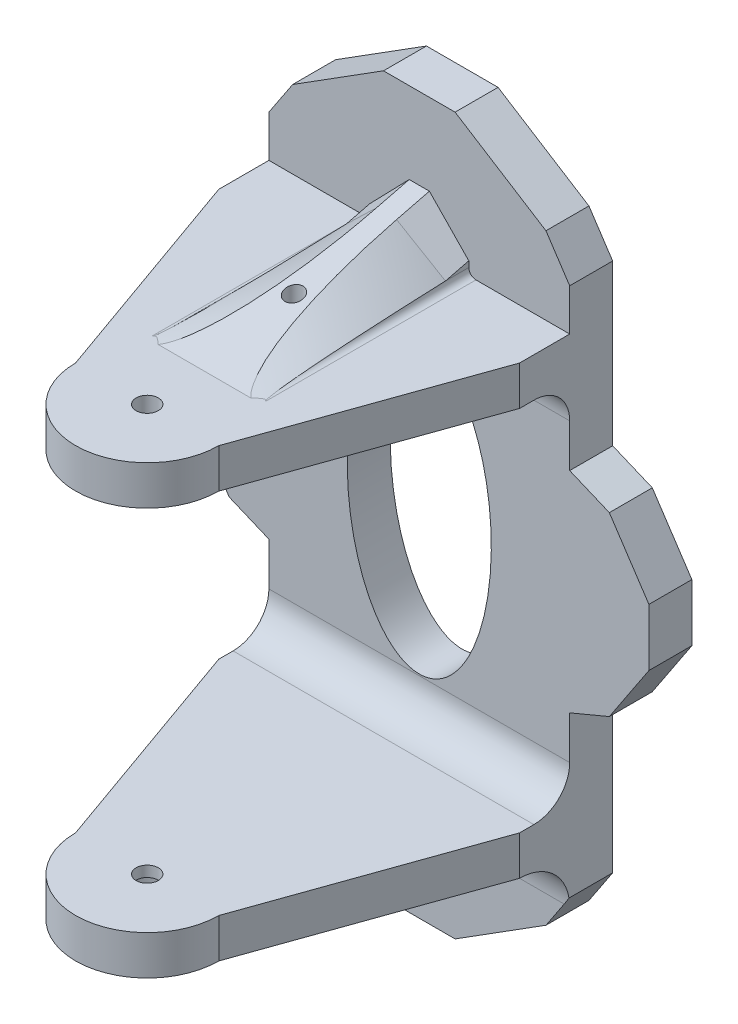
SolidWorks part; units mm, degrees
ref_plane "Front" through (0, 0, 0) normal (0, 0, 1) x (1, 0, 0)
ref_plane "Top" through (0, 0, 0) normal (0, 1, 0) x (1, 0, 0)
ref_plane "Right" through (0, 0, 0) normal (1, 0, 0) x (0, 0, -1)
sketch "Sketch1" plane through (0, 0, 0) normal (0, 0, 1) x (1, 0, 0)
  line L0 (0, 0) -> (0, 100) construction
  line L1 (5, 100) -> (-5, 100)
  line L2 (-5, 100) -> (-17.6886, 92)
  line L3 (-17.6886, 92) -> (-21.0052, 87)
  line L4 (0, 50) -> (-48.9868, 50) construction
  line L5 (-21.0052, 87) -> (-21.0052, 64.6502)
  line L6 (-21.0052, 64.6502) -> (-26.5398, 62.3333)
  line L7 (-26.5398, 62.3333) -> (-32.0676, 54)
  line L8 (-32.0676, 54) -> (-32.0676, 46)
  line L9 (-26.5398, 37.6667) -> (-32.0676, 46)
  line L10 (-21.0052, 35.3498) -> (-26.5398, 37.6667)
  line L11 (-21.0052, 13) -> (-21.0052, 35.3498)
  line L12 (-17.6886, 8) -> (-21.0052, 13)
  line L13 (-5, 0) -> (-17.6886, 8)
  line L14 (5, 0) -> (-5, 0)
  line L15 (5, 0) -> (17.6886, 8)
  line L16 (17.6886, 8) -> (21.0052, 13)
  line L17 (21.0052, 13) -> (21.0052, 35.3498)
  line L18 (21.0052, 35.3498) -> (26.5398, 37.6667)
  line L19 (26.5398, 37.6667) -> (32.0676, 46)
  line L20 (32.0676, 54) -> (32.0676, 46)
  line L21 (26.5398, 62.3333) -> (32.0676, 54)
  line L22 (21.0052, 64.6502) -> (26.5398, 62.3333)
  line L23 (21.0052, 87) -> (21.0052, 64.6502)
  line L24 (17.6886, 92) -> (21.0052, 87)
  line L25 (5, 100) -> (17.6886, 92)
  point P13 (-32.0676, 50)
extrude "Boss-Extrude1" add sketch "Sketch1" along normal blind 6
sketch "Sketch2" plane through (0, 0, 6) normal (0, 0, 1) x (1, 0, 0)
  line L0 (-32.0676, 50) -> (32.0676, 50) construction
  line L1 (-32.0676, 54) -> (-32.0676, 46) construction
  line L2 (32.0676, 46) -> (32.0676, 54) construction
  line L3 (-21.0052, 87) -> (-21.0052, 64.6502) construction
  line L4 (-21.0052, 81.165) -> (21.0052, 81.165)
  line L5 (-21.0052, 81.165) -> (-21.0052, 74.165)
  line L6 (-21.0052, 74.165) -> (21.0052, 74.165)
  line L7 (21.0052, 81.165) -> (21.0052, 74.165)
  line L8 (21.0052, 64.6502) -> (21.0052, 87) construction
  line L9 (21.0052, 18.835) -> (21.0052, 25.835)
  line L10 (-21.0052, 25.835) -> (21.0052, 25.835)
  line L11 (-21.0052, 18.835) -> (-21.0052, 25.835)
  line L12 (-21.0052, 18.835) -> (21.0052, 18.835)
  dimension "D1" = 7
  dimension "D2" = 24.165
extrude "Boss-Extrude2" add sketch "Sketch2" along normal blind 48
sketch "Sketch3" plane through (0, 18.835, 0) normal (0, -1, 0) x (1, 0, 0)
  line L0 (-21.0052, 34) -> (21.0052, 34) construction
  line L1 (-21.0052, 54) -> (-21.0052, 6) construction
  line L2 (21.0052, 54) -> (21.0052, 6) construction
  line L3 (-21.0052, 54) -> (21.0052, 54) construction
  line L4 (0, 54) -> (0, 6) construction
  line L5 (-21.0052, 6) -> (21.0052, 6) construction
  line L6 (10, 54) -> (10, 34) construction
  line L7 (-10, 54) -> (-10, 34) construction
  line L8 (-10, 44) -> (-21.0052, 34)
  line L9 (-21.0052, 34) -> (-21.0052, 54)
  line L10 (-21.0052, 54) -> (0, 54)
  line L11 (0, 54) -> (21.0052, 54)
  line L12 (21.0052, 54) -> (21.0052, 34)
  line L13 (21.0052, 34) -> (10, 44)
  arc A0 (-10, 44) -> (10, 44) centre (0, 44) cw
  dimension "D1" = 20
  dimension "D2" = 10
  dimension "D3" = 10
extrude "Cut-Extrude1" cut sketch "Sketch3" against normal through all contours L8 A0 M6 M7 | A0 L13 M6 M5
fillet "Fillet2" radius 7 1 edges at (0, 18.835, 6)
sketch "Sketch4" plane through (0, 18.835, 0) normal (0, -1, 0) x (1, 0, 0)
  line L0 (-10, 44) -> (-21.0052, 13)
  line L1 (-21.0052, 13) -> (-21.0052, 34)
  line L2 (-21.0052, 34) -> (-10, 44)
  line L3 (0, 54) -> (0, 6) construction
  line L4 (-5, 6) -> (5, 6) construction
  line L5 (10, 44) -> (21.0052, 13)
  line L6 (21.0052, 13) -> (21.0052, 34)
  line L7 (21.0052, 34) -> (10, 44)
  arc A0 (10, 44) -> (-10, 44) centre (0, 44) ccw construction
extrude "Cut-Extrude2" cut sketch "Sketch4" against normal through all
sketch "Sketch9" plane through (0, 81.165, 0) normal (0, 1, 0) x (1, 0, 0)
  line L0 (0, -54) -> (0, -6) construction
  line L1 (21.0052, -6) -> (-21.0052, -6) construction
  line L2 (-5, -6) -> (-17.6886, -6) construction
  line L3 (6.9112, -36) -> (-6.9112, -36)
  line L4 (6.9112, -36) -> (6.9112, -6)
  line L5 (6.9112, -6) -> (-6.9112, -6)
  line L6 (-6.9112, -36) -> (-6.9112, -6)
  line L7 (6.9112, -36) -> (-6.9112, -6) construction
  line L8 (6.9112, -6) -> (-6.9112, -36) construction
  arc A0 (-10, -44) -> (10, -44) centre (0, -44) ccw construction
  point P7 (0, -21)
  dimension "D1" = 30
extrude "Boss-Extrude3" add sketch "Sketch9" along normal blind 10
chamfer "Chamfer1" distance 10 angle 76 1 edges at (0, 91.165, 36)
sketch "Sketch10" plane through (0, 0, 6) normal (0, 0, 1) x (1, 0, 0)
  line L0 (0, 100) -> (0, 0) construction
  line L1 (5, 100) -> (-5, 100) construction
  ellipse E0 centre (0, 50) end of major axis (0, 70.457) minor radius 10.0566
extrude "Cut-Extrude7" cut sketch "Sketch10" against normal blind 10
ref_plane "Plane2" through (0, 0, 8) normal (0, 0, 1) x (1, 0, 0)
sketch "Sketch11" plane through (0, 0, 6) normal (0, 0, 1) x (1, 0, 0)
  line L1 (21.0052, 74.165) -> (-21.0052, 74.165)
  line L2 (21.0052, 74.165) -> (21.0052, 75.665)
  line L3 (21.0052, 75.665) -> (-21.0052, 75.665)
  line L4 (-21.0052, 74.165) -> (-21.0052, 75.665)
  dimension "D1" = 1.5
extrude "Cut-Extrude8" cut sketch "Sketch11" along normal through all
sketch "Sketch12" plane through (0, 0, 6) normal (0, 0, 1) x (1, 0, 0)
  line L1 (-21.0052, 25.835) -> (21.0052, 25.835)
  line L2 (-21.0052, 25.835) -> (-21.0052, 24.335)
  line L3 (-21.0052, 24.335) -> (21.0052, 24.335)
  line L4 (21.0052, 25.835) -> (21.0052, 24.335)
  dimension "D1" = 1.5
extrude "Cut-Extrude9" cut sketch "Sketch12" along normal through all
sketch "Sketch14" plane through (0, 75.665, 0) normal (0, -1, 0) x (1, 0, 0)
  line L0 (0, 54) -> (0, 6) construction
  line L1 (21.0052, 6) -> (-21.0052, 6) construction
  line L2 (-10, 44) -> (10, 44) construction
  line L3 (-6.1, 44) -> (-6.1, 25.8)
  line L4 (6.1, 44) -> (6.1, 25.8)
  line L5 (-6.1, 34.9) -> (6.1, 34.9) construction
  arc A0 (10, 44) -> (-10, 44) centre (0, 44) ccw construction
  arc A1 (-6.1, 44) -> (6.1, 44) centre (0, 44) cw
  arc A2 (-6.1, 25.8) -> (6.1, 25.8) centre (0, 25.8) ccw
  dimension "D1" = 12.2
  dimension "D2" = 18.2
extrude "Cut-Extrude10" cut sketch "Sketch14" against normal blind 3
sketch "Sketch19" plane through (0, 78.665, 0) normal (0, -1, 0) x (1, 0, 0)
  line L0 (-6.1, 44) -> (6.1, 44) construction
  line L1 (-6.1, 44) -> (-6.1, 25.8) construction
  arc A0 (6.1, 44) -> (-6.1, 44) centre (0, 44) ccw construction
sketch "Sketch20" plane through (0, 78.665, 0) normal (0, -1, 0) x (-1, 0, 0)
  circle A0 centre (0, -44) radius 1.55
  dimension "D1" = 3.1
extrude "Cut-Extrude14" cut sketch "Sketch20" against normal blind 6
sketch "Sketch22" plane through (0, 18.835, 0) normal (0, -1, 0) x (1, 0, 0)
  line L0 (-10, 44) -> (10, 44) construction
  circle A0 centre (0, 44) radius 5.05
  dimension "D1" = 10.1
extrude "Cut-Extrude15" cut sketch "Sketch22" against normal blind 4
sketch "Sketch23" plane through (0, 22.835, 0) normal (0, -1, 0) x (1, 0, 0)
  line L0 (-6.1, 44) -> (6.1, 44) construction
  circle A0 centre (0, 44) radius 1.55
  dimension "D1" = 3.1
extrude "Cut-Extrude16" cut sketch "Sketch23" against normal blind 4
fillet "Fillet4" radius 5 2 edges at (0, 24.335, 6) (0, 75.665, 6)
fillet "Fillet5" radius 1 2 edges at (-6.9112, 81.165, 21) (6.9112, 81.165, 21)
chamfer "Chamfer2" distance 5.5 angle 45 4 edges at (-7.2041, 81.4579, 34.8253) (-6.9112, 85.4049, 18.9946) (7.2041, 81.4579, 34.8253) (6.9112, 85.4049, 18.9946)
sketch "Sketch24" plane through (0, 78.665, 0) normal (0, -1, 0) x (1, 0, 0)
  line L0 (0, 50.1) -> (0, 19.7) construction
  line L1 (-6.1, 44) -> (6.1, 44) construction
  arc A0 (6.1, 44) -> (-6.1, 44) centre (0, 44) ccw construction
  arc A1 (-6.1, 25.8) -> (6.1, 25.8) centre (0, 25.8) ccw construction
  circle A2 centre (0, 23.5) radius 1.25
  dimension "D1" = 2.5
  dimension "D2" = 20.5
extrude "Cut-Extrude17" cut sketch "Sketch24" against normal blind 10
scale "Scale1" scale about centroid uniform scaling yes scale factor 0.56
